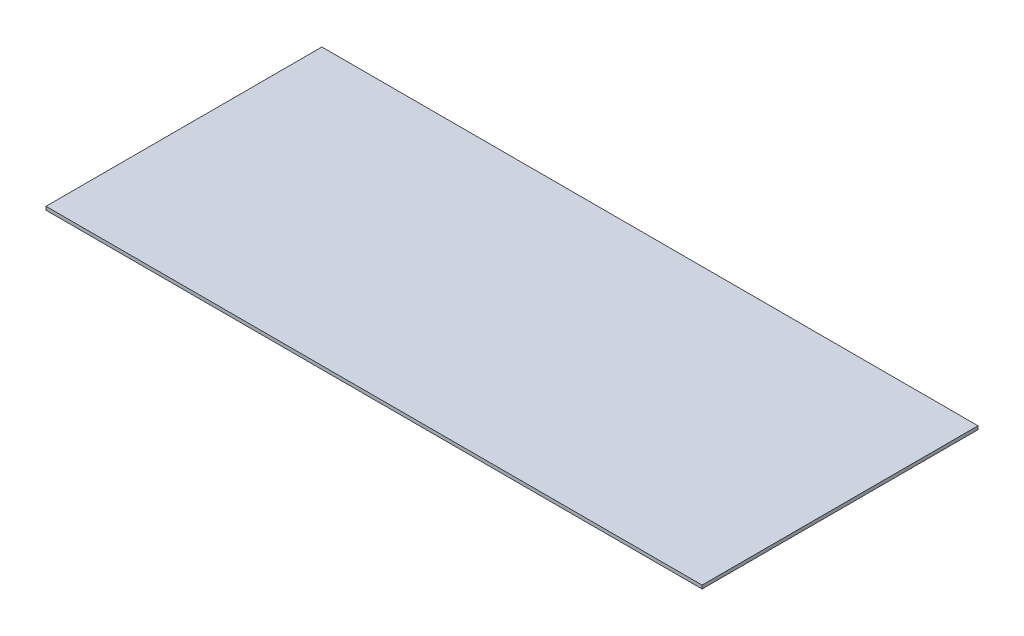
SolidWorks part; units mm, degrees
ref_plane "Front" through (0, 0, 0) normal (0, 0, 1) x (1, 0, 0)
ref_plane "Top" through (0, 0, 0) normal (0, 1, 0) x (1, 0, 0)
ref_plane "Right" through (0, 0, 0) normal (1, 0, 0) x (0, 0, -1)
sketch "Sketch1" plane through (0, 0, 0) normal (0, 1, 0) x (1, 0, 0)
  line L1 (0, 0) -> (-2438.4, 0)
  line L2 (0, 0) -> (0, 1025.398)
  line L3 (0, 1025.398) -> (-2438.4, 1025.398)
  line L4 (-2438.4, 0) -> (-2438.4, 1025.398)
  dimension "D1" = 1025.398
  dimension "D2" = 2438.4
extrude "Extrude1" add sketch "Sketch1" along normal blind 12.7
